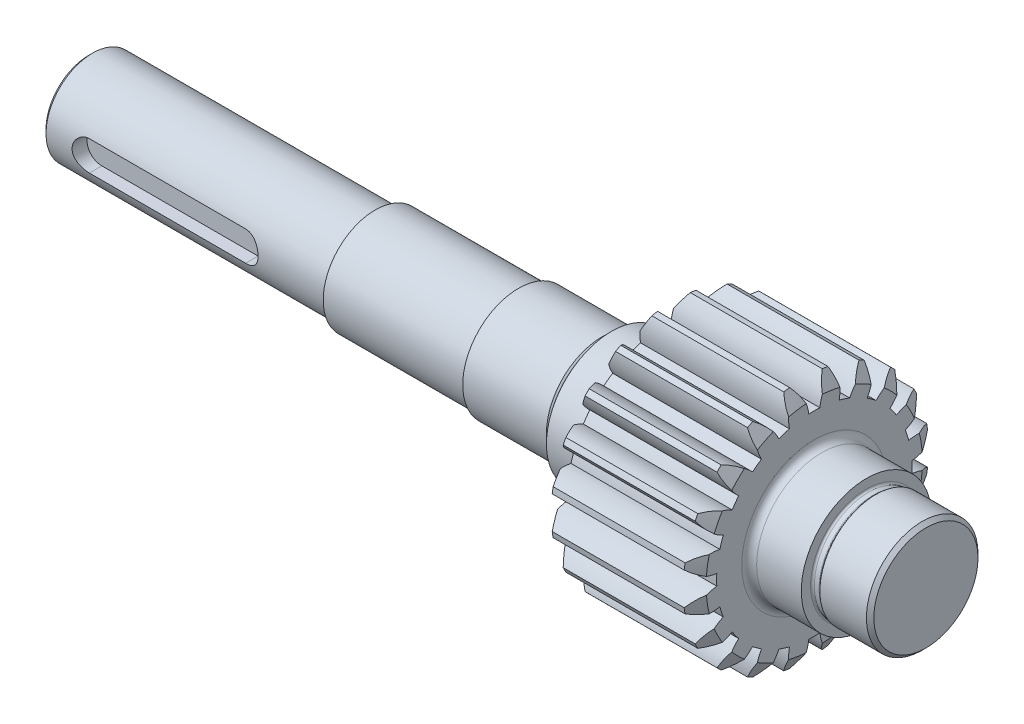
SolidWorks part; units mm, degrees
ref_plane "Plane1" through (0, 0, 0) normal (0, 0, 1) x (1, 0, 0)
ref_plane "Plane2" through (0, 0, 0) normal (0, 1, 0) x (1, 0, 0)
ref_plane "Plane3" through (0, 0, 0) normal (1, 0, 0) x (0, 0, -1)
sketch "HoldingSke" plane through (0, 0, 0) normal (0, 1, 0) x (1, 0, 0)
  line L0 (0, 0) -> (0.3132, -0.114)
  line L1 (-15, 0) -> (100, 0) construction
  line L2 (0, 0) -> (-2.1039, 2.3779)
  line L3 (0, 0) -> (-11.863, 4.5341)
  line L4 (0, 0) -> (8.1152, 2.9537)
  line L5 (0, 0) -> (-46.8476, -17.4728)
  line L6 (0, 0) -> (-41.4481, -27.9652)
  line L7 (-2.1039, 2.3779) -> (8.6605, 51.2146)
  line L8 (-76.2, 54.61) -> (-76.1, 54.61)
  line L9 (-71.009, 38.7566) -> (-53.1078, 45.2721)
  line L10 (-76.2, 71.12) -> (104.1128, 71.12)
  line L11 (0, 0) -> (-50, 0)
  line L12 (-76.2, 101.6) -> (-76.093, 101.6)
  line L13 (24.9733, 27.94) -> (52.9518, 28.4284)
  line L14 (24.9733, 27.94) -> (24.9743, 27.94)
  line L15 (24.9733, 27.94) -> (100.4006, 29.5858)
  line L16 (-63.627, -3) -> (-12.827, -3)
  circle A0 centre (0, 0) radius 0.1
  circle A1 centre (0, 0) radius 26.249
  circle A2 centre (0, 0) radius 37.5
  circle A3 centre (0, 0) radius 0.1
sketch "BasProSke" plane through (0, 0, 0) normal (0, 1, 0) x (1, 0, 0)
  line L0 (-10, 0) -> (60, 0) construction
  line L1 (0, 0) -> (0, 33)
  line L2 (0, 0) -> (40, 0)
  line L3 (40, 0) -> (40, 33)
  line L4 (40, 33) -> (0, 33)
revolve "Base-Revolve" add sketch "BasProSke" angle 360 about L0
sketch "TooCutSke" plane through (0, 0, 0) normal (1, 0, 0) x (0, 0, -1)
  line L1 (0, 0) -> (0, 107) construction
  line L2 (0, 0) -> (-2.5409, 29.8922) construction
  line L3 (0, 0) -> (-9.3616, 59.1066) construction
  line L4 (-2.5409, 29.8922) -> (-4.6808, 29.5533) construction
  arc A0 (1.4893, 26.2067) -> (-1.4893, 26.2067) centre (0, 0) ccw
  arc A1 (4.4016, 32.7308) -> (-4.4016, 32.7308) centre (0, 0) ccw
  circle A2 centre (0, 0) radius 30 construction
  circle A3 centre (0, 0) radius 28.1908 construction
  arc A4 (-1.4893, 26.2067) -> (-4.4016, 32.7308) centre (-13.4064, 24.799) ccw
  arc A5 (4.4016, 32.7308) -> (1.4893, 26.2067) centre (13.4064, 24.799) ccw
extrude "ToothCut" cut sketch "TooCutSke" along normal through all
fillet "Breaks" [suppressed] radius 0.06
fillet "RootFillets" [suppressed] radius 0.751
pattern_circular "TeethCuts" count 20 every 18 about axis through (-10, 0, 0) along (1, 0, 0) of "ToothCut", "RootFillets", "Breaks"
sketch "HubNeaOneSke" plane through (0, 0, 0) normal (-1, 0, 0) x (0, 0, 1)
  circle A0 centre (0, 0) radius 26.249
extrude "HubNearOne" [suppressed] add sketch "HubNeaOneSke" along normal blind 0.0057
sketch "HubNeaBotSke" plane through (0, 0, 0) normal (-1, 0, 0) x (0, 0, 1)
  circle A0 centre (0, 0) radius 26.249
extrude "HubNearBoth" [suppressed] add sketch "HubNeaBotSke" along normal blind 0.0029
ref_plane "FarPln" through (50, 0, 0) normal (1, 0, 0) x (0, 0, -1)
sketch "HubFarSke" plane through (50, 0, 0) normal (1, 0, 0) x (0, 0, -1)
  circle A0 centre (0, 0) radius 26.249
extrude "HubFar" [suppressed] add sketch "HubFarSke" along normal blind 0.0029
sketch "BorSke" plane through (0, 0, 0) normal (1, 0, 0) x (0, 0, -1)
  circle A0 centre (0, 0) radius 0.1
sketch "KeySke" plane through (0, 0, 0) normal (1, 0, 0) x (0, 0, -1)
  line L0 (-0.05, 0) -> (-0.05, 0.2)
  line L1 (-0.05, 0.2) -> (0.05, 0.2)
  line L2 (0.05, 0.2) -> (0.05, 0)
  line L3 (0, 0) -> (0, 34) construction
  line L4 (-0.05, 0) -> (0.05, 0)
extrude "Keyway" [suppressed] cut sketch "KeySke" along normal mid plane 100.0179
pattern_circular "Keyway2" [suppressed] count 2 every 90 about axis through (-10, 0, 0) along (1, 0, 0)
sketch "Sketch1" plane through (0, 0, 0) normal (0, 0, 1) x (1, 0, 0)
  line L0 (199.554, 0) -> (-221.3943, 0) construction
  line L1 (40, 0) -> (40, 17.5)
  line L2 (40, -1.4893) -> (40, 1.4893) construction
  line L3 (40, 17.5) -> (54, 17.5)
  line L4 (54, 17.5) -> (54, 15)
  line L5 (54, 15) -> (70, 15)
  line L6 (70, 15) -> (70, 0)
  line L7 (70, 0) -> (40, 0)
  line L8 (0, 0) -> (0, 17.5)
  line L9 (0, 17.5) -> (-14.5, 17.5)
  line L10 (-14.5, 17.5) -> (-14.5, 15)
  line L11 (-14.5, 15) -> (-39.5, 15)
  line L12 (-39.5, 15) -> (-39.5, 14)
  line L13 (-39.5, 14) -> (-78, 14)
  line L14 (-78, 14) -> (-78, 12.5)
  line L15 (-78, 12.5) -> (-155, 12.5)
  line L16 (-155, 12.5) -> (-155, 0)
  line L17 (-155, 0) -> (0, 0)
  dimension "D1" = 30
  dimension "D2" = 35
  dimension "D3" = 16
  dimension "D4" = 30
  dimension "D5" = 25
  dimension "D6" = 28
  dimension "D7" = 30
  dimension "D8" = 35
  dimension "D9" = 68.5
  dimension "D10" = 25
  dimension "D11" = 132
  dimension "D12" = 225
revolve "Revolve1" add sketch "Sketch1" angle 360 about L0
chamfer "Chamfer1" distance 1 angle 45 2 edges at (70, 0, -15) (-155, 0, -12.5)
sketch "Sketch2" plane through (0, 0, 0) normal (0, 0, 1) x (1, 0, 0)
  line L0 (40.5, 33.2078) -> (40.5, 28.2078)
  line L1 (40.5, 28.2078) -> (37.6132, 33.2078)
  line L2 (37.6132, 33.2078) -> (40.5, 33.2078)
  line L3 (40, 25.3843) -> (40, 32.461) construction
  line L4 (0, 32.7078) -> (40, 32.7078) construction
  line L5 (20, -32.7078) -> (20, 87.7883) construction
  line L6 (40, -32.7078) -> (0, -32.7078) construction
  line L7 (2.3868, 33.2078) -> (-0.5, 33.2078)
  line L8 (-0.5, 28.2078) -> (2.3868, 33.2078)
  line L9 (-0.5, 33.2078) -> (-0.5, 28.2078)
  line L10 (101.7484, 0) -> (-209.2648, 0) construction
  dimension "D1" = 0.5
  dimension "D2" = 0.5
  dimension "D3" = 30
  dimension "D4" = 5
revolve "Cut-Revolve1" cut sketch "Sketch2" angle 360 about L10
ref_plane "Plane4" through (0, 0, 12.5) normal (0, 0, 1) x (1, 0, 0)
sketch "Sketch3" plane through (0, 0, 12.5) normal (0, 0, 1) x (1, 0, 0)
  line L0 (-189.8027, 0) -> (104.5269, 0) construction
  line L1 (-143, 4) -> (-101, 4)
  line L2 (-101, -4) -> (-143, -4)
  line L4 (-155, 11.5) -> (-155, -11.5) construction
  arc A0 (-143, 4) -> (-143, -4) centre (-143, 0) ccw
  arc A1 (-101, -4) -> (-101, 4) centre (-101, 0) ccw
  point P11 (-147, 0)
  point P12 (-97, 0)
  dimension "D1" = 4
  dimension "D2" = 8
  dimension "D3" = 50
extrude "Cut-Extrude1" cut sketch "Sketch3" against normal blind 4
sketch "Sketch4" plane through (0, 0, 0) normal (0, 0, 1) x (1, 0, 0)
  line L0 (115.9288, 0) -> (-203.3236, 0) construction
  line L1 (54, 15) -> (54, 14.5)
  line L2 (54, -15) -> (54, 15) construction
  line L3 (54, -17.5) -> (54, 17.5) construction
  line L4 (54, 14.5) -> (56, 14.5)
  line L5 (56, 14.5) -> (56.5, 15)
  line L6 (56.5, 15) -> (54, 15)
  line L7 (69, 15) -> (54, 15) construction
  dimension "D1" = 45
  dimension "D2" = 0.5
  dimension "D3" = 2
revolve "Cut-Revolve2" cut sketch "Sketch4" angle 360 about L0
sketch "Sketch5" plane through (0, 0, 0) normal (0, 0, 1) x (1, 0, 0)
  line L0 (-173.3198, 0) -> (117.8403, 0) construction
  line L1 (-14.5, 15) -> (-14.5, 14.5)
  line L2 (-14.5, 17.5) -> (-14.5, -17.5) construction
  line L3 (-14.5, 14.5) -> (-16.5, 14.5)
  line L4 (-16.5, 14.5) -> (-17, 15)
  line L5 (-14.5, 15) -> (-39.5, 15) construction
  line L6 (-17, 15) -> (-14.5, 15)
  dimension "D1" = 45
  dimension "D2" = 0.5
  dimension "D3" = 2
revolve "Cut-Revolve3" cut sketch "Sketch5" angle 360 about L0
fillet "Fillet1" radius 0.5 4 edges at (54, 0, -14.5) (56, 0, -14.5) (-16.5, 0, 14.5) (-14.5, 0, 14.5)
fillet "Fillet2" radius 2 2 edges at (0, 0, -17.5) (40, 0, -17.5)
fillet "Fillet3" radius 0.5 1 edges at (-78, 0, -12.5)
equation "' \"Module@HoldingSke\" = 6.35"
equation "' \"Num_teeth@HoldingSke\" = 12"
equation "' \"Ap@HoldingSke\" =  20"
equation "' \"Ap@HoldingSke\" = 20"
equation "' \"Width@HoldingSke\" = 0.5 * 25.4"
equation "' \"Hub_dia@HoldingSke\"= 1 * 25.4"
equation "' \"Hub_dia@HoldingSke\" = 1 * 25.4"
equation "' \"Overall_len@HoldingSke\" = 1.0 * 25.4"
equation "' \"Bore@HoldingSke\" = 0.75 * 25.4"
equation "' \"T_dim@HoldingSke\" = 0.1 * 25.4"
equation "' \"Width@KeySke\" = 0.25 * 25.4"
equation "' \"Show_teeth@HoldingSke\" = 13"
equation "' \"Backlash@HoldingSke\" = 0.009 * 25.4"
equation "' \"Addendum_fac@HoldingSke\" = 1.0"
equation "' \"Dedendum_fac@HoldingSke\" = 1.25"
equation "' \"Dedendum_add@HoldingSke\" = 0.00005 * 25.4"
equation "' \"Clearance_fac@HoldingSke\" = 0.25"
equation "\"Pitch@HoldingSke\" = 1 / \"Module@HoldingSke\""
equation "\"Overcut_dia@TooCutSke\" = (\"Num_teeth@HoldingSke\" + 2 * \"Addendum_fac@HoldingSke\") / \"Pitch@HoldingSke\" + 0.002 * 25.4"
equation "\"Pitch_dia@TooCutSke\" = \"Num_teeth@HoldingSke\" / \"Pitch@HoldingSke\""
equation "\"Base_dia@TooCutSke\" = \"Num_teeth@HoldingSke\" / \"Pitch@HoldingSke\" * cos((\"Ap@HoldingSke\"  * 3.14159265 / 180))"
equation "\"Root_dia@TooCutSke\" = (\"Num_teeth@HoldingSke\" + 2) / \"Pitch@HoldingSke\" - 2 * (\"Addendum_fac@HoldingSke\" + \"Dedendum_fac@HoldingSke\") / \"Pitch@HoldingSke\" - \"Dedendum_add@HoldingSke\" * 2"
equation "\"Half_ang@TooCutSke\" = 180 / \"Num_teeth@HoldingSke\""
equation "\"Half_CT@TooCutSke\" = \"Num_teeth@HoldingSke\" / \"Pitch@HoldingSke\" * sin((3.14159265 / 2 / \"Num_teeth@HoldingSke\")) / 2 - 7 * \"Backlash@HoldingSke\" / 4"
equation "\"Flank_rad@TooCutSke\" = \"Num_teeth@HoldingSke\" / \"Pitch@HoldingSke\" / 5"
equation "\"Radius@RootFillets\" = \"Clearance_fac@HoldingSke\" / \"Pitch@HoldingSke\" + \"Dedendum_add@HoldingSke\""
equation "\"Break_rad@Breaks\" = 0.02 / \"Pitch@HoldingSke\""
equation "\"Thickness@HoldingSke\" = \"Width@HoldingSke\""
equation "\"OAL@HoldingSke\" = \"Thickness@HoldingSke\""
equation "\"MHD@HoldingSke\" = (\"Num_teeth@HoldingSke\" + 2) / \"Pitch@HoldingSke\" - 2 * (\"Addendum_fac@HoldingSke\" + \"Dedendum_fac@HoldingSke\")  / \"Pitch@HoldingSke\" - \"Dedendum_add@HoldingSke\" * 2"
equation "\"MBD@HoldingSke\" = (\"Num_teeth@HoldingSke\" + 2) / \"Pitch@HoldingSke\" - 2 * (\"Addendum_fac@HoldingSke\" + \"Dedendum_fac@HoldingSke\")  / \"Pitch@HoldingSke\" - \"Dedendum_add@HoldingSke\" * 2 - 0.002 * 25.4"
equation "\"MHD@HoldingSke\" = ((sgn( \"MHD@HoldingSke\" - \"Hub_dia@HoldingSke\" )-1)*( \"MHD@HoldingSke\" - \"Hub_dia@HoldingSke\" ))/-2+ \"Hub_dia@HoldingSke\""
equation "\"MBD@HoldingSke\" = ((sgn( \"MBD@HoldingSke\" - \"Bore@HoldingSke\" )-1)*( \"MBD@HoldingSke\" - \"Bore@HoldingSke\" ))/-2+ \"Bore@HoldingSke\""
equation "\"OAL@HoldingSke\" = ((sgn( \"OAL@HoldingSke\" - \"Overall_len@HoldingSke\" )+1)*( \"OAL@HoldingSke\" - \"Overall_len@HoldingSke\" ))/2 + \"Overall_len@HoldingSke\" + 0.000002 * 25.4"
equation "\"Num_teeth@TeethCuts\" = int( \"Show_teeth@HoldingSke\" ) + 1"
equation "\"Num_teeth@TeethCuts\" = ((sgn( \"Num_teeth@TeethCuts\" - \"Num_teeth@HoldingSke\" )-1)*( \"Num_teeth@TeethCuts\" - \"Num_teeth@HoldingSke\" ))/-2+ \"Num_teeth@HoldingSke\""
equation "\"Num_teeth@TeethCuts\" = ((sgn( \"Num_teeth@TeethCuts\" - 2.0)+1)*( \"Num_teeth@TeethCuts\" - 2.0))/2 +2.0"
equation "\"Angle@TeethCuts\" = 360.0 / \"Num_teeth@HoldingSke\""
equation "\"Diameter@BasProSke\" = (\"Num_teeth@HoldingSke\" + 2 * \"Addendum_fac@HoldingSke\") / \"Pitch@HoldingSke\""
equation "\"Thickness@BasProSke\"  = \"Thickness@HoldingSke\""
equation "' \"Fillet_rad@BasProSke\" =  \"Thickness@HoldingSke\" * 0.05"
equation "' \"Fillet_rad@BasProSke\" = \"Thickness@HoldingSke\" * 0.05"
equation "\"MHD@HoldingSke\" = ((sgn( \"MHD@HoldingSke\" - \"Root_dia@TooCutSke\" )-1)*( \"MHD@HoldingSke\" - \"Root_dia@TooCutSke\" ))/-2+ \"Root_dia@TooCutSke\""
equation "\"Diameter@HubNeaOneSke\" = \"MHD@HoldingSke\""
equation "\"Length@HubNearOne\" = \"OAL@HoldingSke\" - \"Thickness@BasProSke\""
equation "\"Diameter@HubNeaBotSke\" = \"MHD@HoldingSke\""
equation "\"Length@HubNearBoth\" = ( \"OAL@HoldingSke\" - \"Thickness@BasProSke\" ) / 2.0"
equation "\"Thickness@FarPln\" = \"Thickness@BasProSke\""
equation "\"Diameter@HubFarSke\" = \"MHD@HoldingSke\""
equation "\"Length@HubFar\" = ( \"OAL@HoldingSke\" - \"Thickness@BasProSke\" ) / 2.0"
equation "\"Diameter@BorSke\" = \"MBD@HoldingSke\""
equation "\"D1@Bore\" = \"OAL@HoldingSke\" * 2.0"
equation "\"D1@Keyway\" = \"OAL@HoldingSke\" * 2.0"
equation "\"Offset@KeySke\" = \"T_dim@HoldingSke\" + \"MBD@HoldingSke\" / 2.0"
